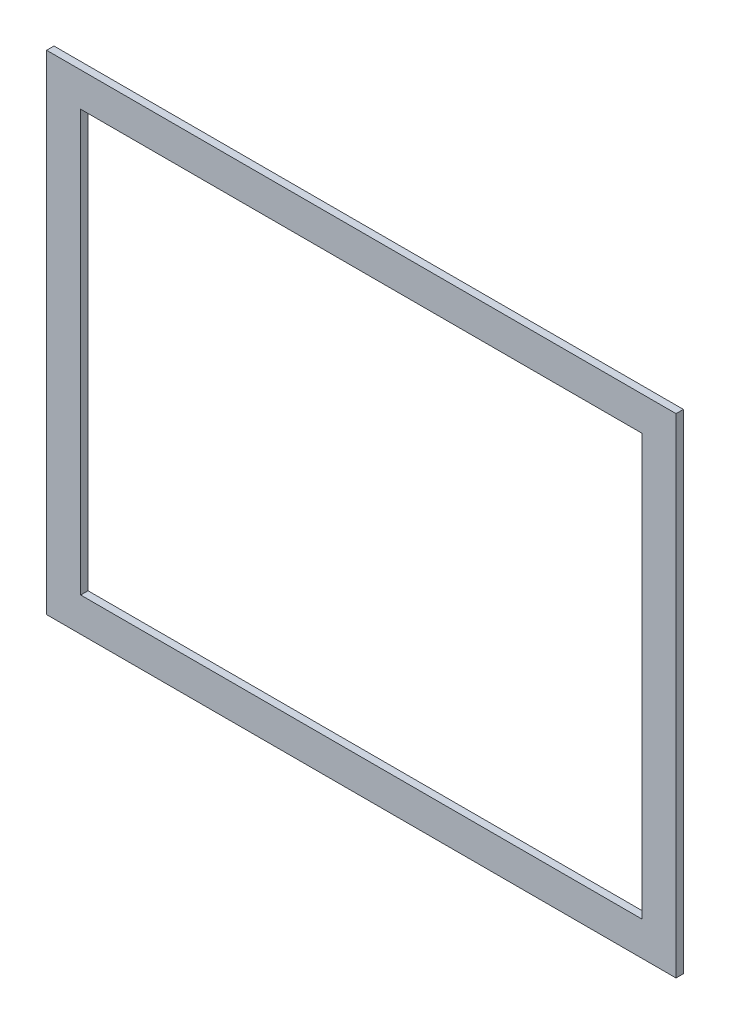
SolidWorks part; units mm, degrees
ref_plane "Plan de face" through (0, 0, 0) normal (0, 0, 1) x (1, 0, 0)
ref_plane "Plan de dessus" through (0, 0, 0) normal (0, 1, 0) x (1, 0, 0)
ref_plane "Plan de droite" through (0, 0, 0) normal (1, 0, 0) x (0, 0, -1)
sketch "Esquisse1" plane through (0, 0, 0) normal (0, 0, 1) x (1, 0, 0)
  line L1 (-30.7, 58.89) -> (29.3, 58.89) construction
  line L2 (-30.7, 58.89) -> (-30.7, 14.79) construction
  line L3 (-30.7, 14.79) -> (29.3, 14.79) construction
  line L4 (29.3, 58.89) -> (29.3, 14.79) construction
  line L5 (-28.7, 56.89) -> (25.3, 56.89) construction
  line L6 (-28.7, 56.89) -> (-28.7, 16.79) construction
  line L7 (-28.7, 16.79) -> (25.3, 16.79) construction
  line L8 (25.3, 56.89) -> (25.3, 16.79) construction
  line L9 (-30.2, 58.39) -> (-30.2, 15.29)
  line L10 (-27.2, 55.39) -> (22.3, 55.39)
  line L11 (-27.2, 55.39) -> (-27.2, 18.29)
  line L12 (-27.2, 18.29) -> (22.3, 18.29)
  line L13 (22.3, 55.39) -> (22.3, 18.29)
  line L14 (-30.2, 15.29) -> (25.3, 15.29)
  line L15 (25.3, 58.39) -> (25.3, 15.29)
  line L16 (-30.2, 58.39) -> (25.3, 58.39)
  dimension "D1" = 1.5
  dimension "D2" = 1.5
  dimension "D3" = 3
  dimension "D4" = 1.5
  dimension "D5" = 3
extrude "Boss.-Extru.1" add sketch "Esquisse1" along normal blind 0.65 contours L2 L3 L4 L1
